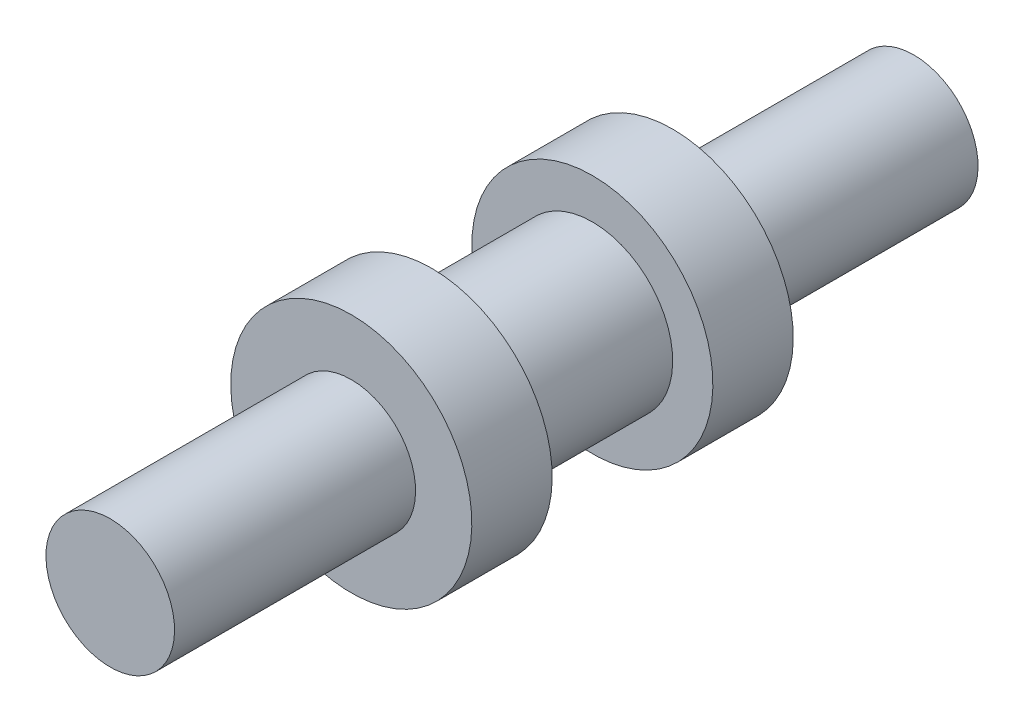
SolidWorks part; units mm, degrees
ref_plane "Front Plane" through (0, 0, 0) normal (0, 0, 1) x (1, 0, 0)
ref_plane "Top Plane" through (0, 0, 0) normal (0, 1, 0) x (1, 0, 0)
ref_plane "Right Plane" through (0, 0, 0) normal (1, 0, 0) x (0, 0, -1)
sketch "Sketch1" plane through (0, 0, 0) normal (1, 0, 0) x (0, 0, -1)
  line L0 (-6.35, 6.35) -> (6.35, 6.35)
  line L1 (6.35, 6.35) -> (6.35, 9.525)
  line L2 (6.35, 9.525) -> (12.7, 9.525)
  line L3 (12.7, 9.525) -> (12.7, 5.08)
  line L4 (12.7, 5.08) -> (31.75, 5.08)
  line L5 (31.75, 5.08) -> (31.75, 0)
  line L6 (31.75, 0) -> (-31.75, 0)
  line L7 (0, 0) -> (0, 36.1925) construction
  line L10 (-31.75, 5.08) -> (-31.75, 0)
  line L11 (-12.7, 5.08) -> (-31.75, 5.08)
  line L12 (-12.7, 9.525) -> (-12.7, 5.08)
  line L13 (-6.35, 9.525) -> (-12.7, 9.525)
  line L14 (-6.35, 6.35) -> (-6.35, 9.525)
  dimension "D1" = 12.7
  dimension "D2" = 6.35
  dimension "D3" = 19.05
  dimension "D4" = 6.35
  dimension "D5" = 5.08
  dimension "D6" = 9.525
revolve "Revolve1" add sketch "Sketch1" angle 360 about L6
